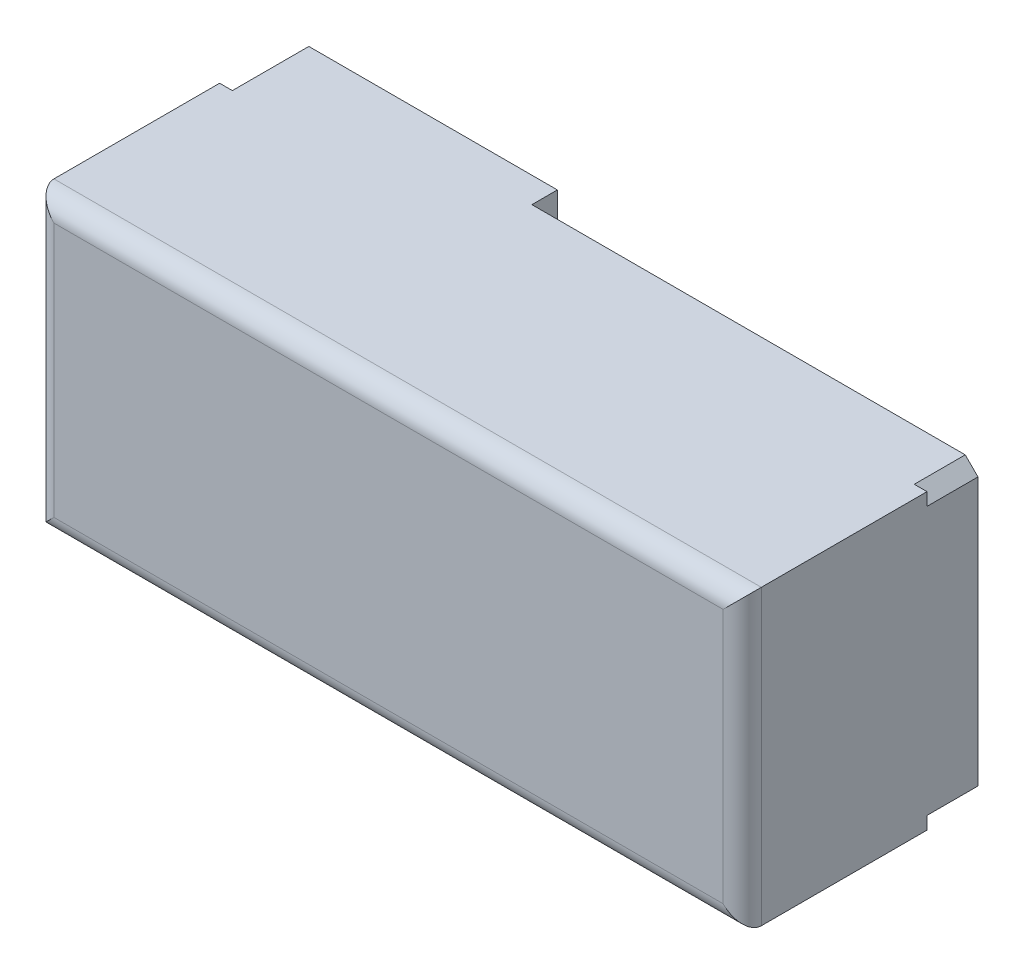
SolidWorks part; units mm, degrees
ref_plane "前视基准面" through (0, 0, 0) normal (0, 0, 1) x (1, 0, 0)
ref_plane "上视基准面" through (0, 0, 0) normal (0, 1, 0) x (1, 0, 0)
ref_plane "右视基准面" through (0, 0, 0) normal (1, 0, 0) x (0, 0, -1)
sketch "草图1" plane through (0, 0, 0) normal (0, 0, 1) x (1, 0, 0)
  line L1 (0, 0) -> (50000, 0) construction
  line L2 (0, 0) -> (0, 50000) construction
  line L3 (-55.5, -23) -> (55.5, -23)
  line L4 (-55.5, -23) -> (-55.5, 23)
  line L5 (-55.5, 23) -> (55.5, 23)
  line L6 (55.5, -23) -> (55.5, 23)
  line L7 (-55.5, -23) -> (55.5, 23) construction
  line L8 (-55.5, 23) -> (55.5, -23) construction
  point P0 (0, 0)
  dimension "D1" = 111
  dimension "D2" = 46
extrude "凸台-拉伸1" add sketch "草图1" along normal blind 8
sketch "草图2" plane through (0, 0, 8) normal (0, 0, 1) x (1, 0, 0)
  line L0 (0, 0) -> (50000, 0) construction
  line L1 (-34.5, -4.609) -> (-34.5, 49995.391) construction
  line L2 (24, -7.691) -> (24, -5.5896) construction
  line L3 (-55.5, 23) -> (-55.5, -23) construction
  line L4 (19, 0) -> (29, 0) construction
  line L5 (19, 5) -> (29, 5)
  line L6 (19, -5) -> (29, -5)
  circle A0 centre (-34.5, 0) radius 7.5
  arc A1 (19, 5) -> (19, -5) centre (19, 0) ccw
  arc A2 (29, -5) -> (29, 5) centre (29, 0) ccw
  point P13 (24, 0)
  dimension "D3" = 15
  dimension "D4" = 5
  dimension "D1" = 21
  dimension "D2" = 58.5
  dimension "D5" = 10
extrude "切除-拉伸1" cut sketch "草图2" against normal through all
chamfer "倒角2" distance 2 angle 45 4 edges at (-55.5, -23, 4) (55.5, -23, 4) (-55.5, 23, 4) (55.5, 23, 4)
sketch "草图12" plane through (0, 0, 0) normal (0, 0, -1) x (-1, 0, 0)
  line L0 (-53.5, 23) -> (53.5, 23) construction
  line L1 (14.5, 23) -> (53.5, 23)
  line L2 (14.5, 23) -> (14.5, -23)
  line L3 (14.5, -23) -> (53.5, -23)
  line L5 (55.5, 21) -> (55.5, -21) construction
  line L7 (55.5, 21) -> (53.5, 23)
  line L8 (55.5, 21) -> (55.5, -21)
  line L9 (55.5, -21) -> (53.5, -23)
  dimension "D1" = 41
extrude "凸台-拉伸3" add sketch "草图12" along normal blind 4
sketch "草图13" plane through (0, 0, 0) normal (0, 0, 1) x (1, 0, 0)
  circle A0 centre (-34.5, 0) radius 15.1
extrude "切除-拉伸4" cut sketch "草图13" against normal through all
sketch "草图14" plane through (0, 0, 8) normal (0, 0, 1) x (1, 0, 0)
  line L0 (-1044.8259, 23) -> (48955.1741, 23) construction
  line L2 (-1009.0317, -23) -> (48990.9683, -23) construction
  line L4 (-55.5, -994.6253) -> (-55.5, 49005.3747) construction
  line L7 (55.5, -1006.372) -> (55.5, 48993.628) construction
  line L9 (-55.5, 23) -> (55.5, 23)
  line L10 (-55.5, 23) -> (-55.5, -23)
  line L11 (-55.5, -23) -> (55.5, -23)
  line L12 (55.5, 23) -> (55.5, -23)
extrude "凸台-拉伸4" add sketch "草图14" along normal blind 29
fillet "圆角1" radius 3 4 edges at (55.5, 0, 37) (0, 23, 37) (-55.5, 0, 37) (0, -23, 37)
